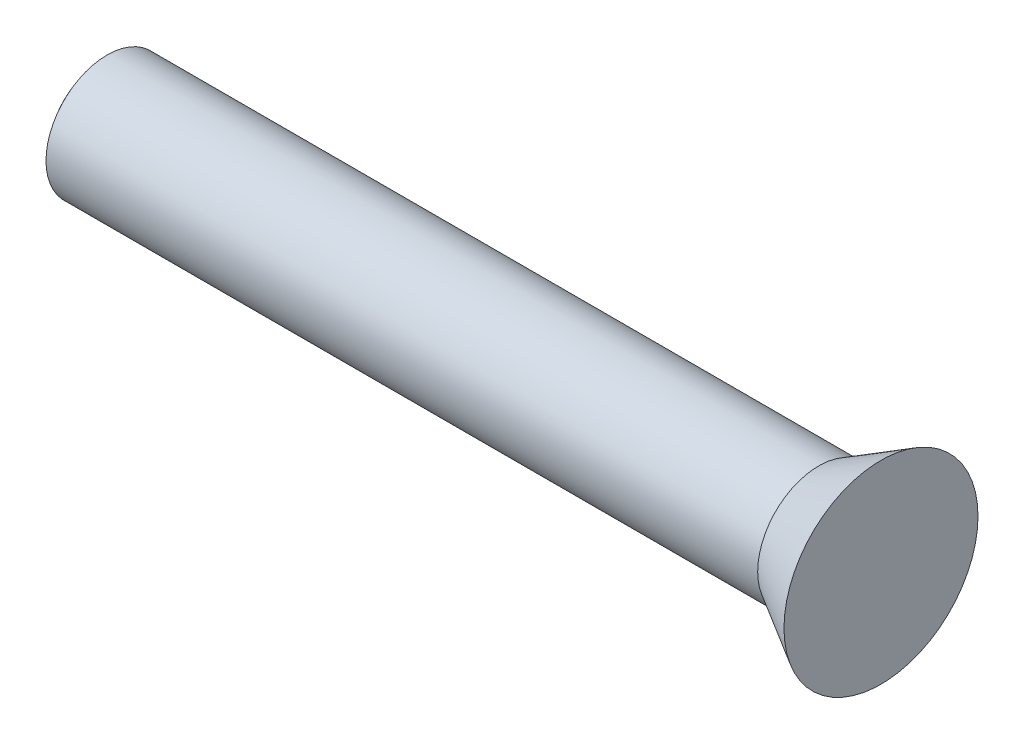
SolidWorks part; units mm, degrees
ref_plane "Front Plane" through (0, 0, 0) normal (0, 0, 1) x (1, 0, 0)
ref_plane "Top Plane" through (0, 0, 0) normal (0, 1, 0) x (1, 0, 0)
ref_plane "Right Plane" through (0, 0, 0) normal (1, 0, 0) x (0, 0, -1)
sketch "Sketch1" plane through (0, 0, 0) normal (0, 0, 1) x (1, 0, 0)
  line L0 (0, 0) -> (10.414, 0)
  line L1 (10.414, 0) -> (10.414, 1.27)
  line L2 (10.414, 1.27) -> (9.5999, 0.8)
  line L3 (9.5999, 0.8) -> (0.2836, 0.8)
  line L4 (0, 0.8) -> (0, 0) construction
  line L5 (0, 0.8) -> (0.2836, 0.8) construction
  arc A0 (0, 0) -> (0.2836, 0.8) centre (1.27, 0) cw
  dimension "D5" = 1.27
  dimension "D1" = 10.414
  dimension "D2" = 1.27
  dimension "D3" = 0.8
  dimension "D4" = 30
revolve "Revolve1" add sketch "Sketch1" angle 360 about L0
